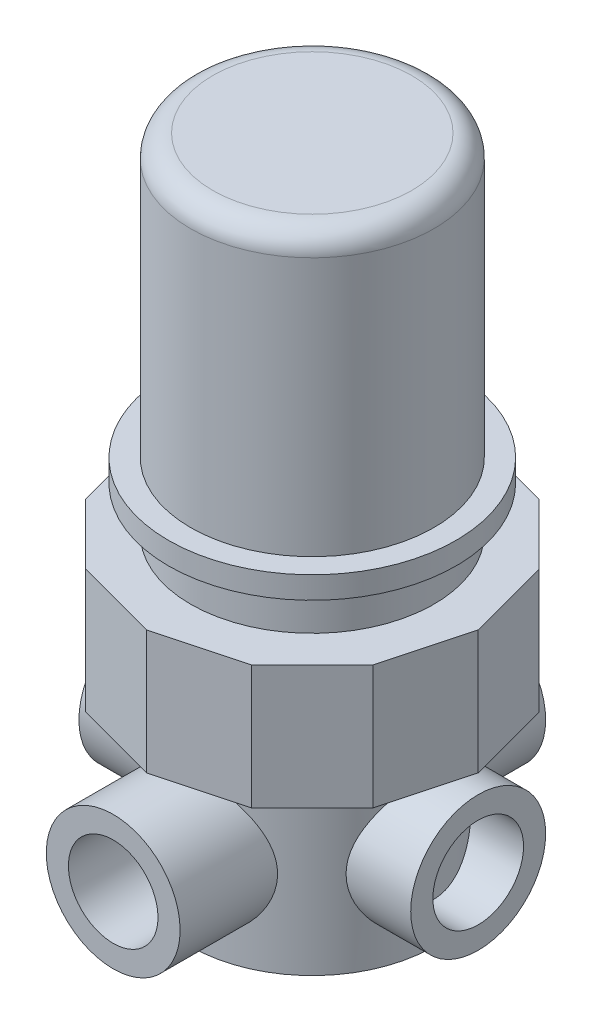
SolidWorks part; units mm, degrees
ref_plane "Front Plane" through (0, 0, 0) normal (0, 0, 1) x (1, 0, 0)
ref_plane "Top Plane" through (0, 0, 0) normal (0, 1, 0) x (1, 0, 0)
ref_plane "Right Plane" through (0, 0, 0) normal (1, 0, 0) x (0, 0, -1)
sketch "Sketch1" plane through (0, 0, 0) normal (0, 0, 1) x (1, 0, 0)
  line L0 (0, 73.914) -> (0, 0) construction
  line L1 (0, 73.914) -> (13.97, 73.914)
  line L2 (13.97, 73.914) -> (13.97, 41.656)
  line L3 (13.97, 41.656) -> (16.51, 41.656)
  line L4 (16.51, 41.656) -> (16.51, 39.116)
  line L5 (16.51, 39.116) -> (13.97, 39.116)
  line L6 (13.97, 39.116) -> (13.97, 34.036)
  line L7 (13.97, 34.036) -> (19.05, 34.036)
  line L8 (19.05, 34.036) -> (19.05, 19.812)
  line L9 (19.05, 19.812) -> (13.97, 19.812)
  line L10 (13.97, 19.812) -> (13.97, 0)
  line L11 (13.97, 0) -> (0, 0)
  line L12 (0, 73.914) -> (0, 0)
  point P11 (13.97, 9.906)
  dimension "D1" = 73.914
  dimension "D2" = 24.13
  dimension "D3" = 64.008
  dimension "D4" = 38.1
  dimension "D5" = 27.94
  dimension "D6" = 27.94
  dimension "D7" = 2.54
  dimension "D8" = 2.54
  dimension "D9" = 5.08
revolve "Revolve1" add sketch "Sketch1" angle 360 about L0
sketch "Sketch2" plane through (0, 34.036, 0) normal (0, 1, 0) x (1, 0, 0)
  line L1 (0, 19.05) -> (-9.525, 16.4978)
  line L2 (-9.525, 16.4978) -> (-16.4978, 9.525)
  line L3 (-16.4978, 9.525) -> (-19.05, 0)
  line L4 (-19.05, 0) -> (-16.4978, -9.525)
  line L5 (-16.4978, -9.525) -> (-9.525, -16.4978)
  line L6 (-9.525, -16.4978) -> (0, -19.05)
  line L7 (0, -19.05) -> (9.525, -16.4978)
  line L8 (9.525, -16.4978) -> (16.4978, -9.525)
  line L9 (16.4978, -9.525) -> (19.05, 0)
  line L10 (19.05, 0) -> (16.4978, 9.525)
  line L11 (16.4978, 9.525) -> (9.525, 16.4978)
  line L12 (9.525, 16.4978) -> (0, 19.05)
  circle A0 centre (0, 0) radius 18.4009 construction
  circle A1 centre (0, 0) radius 19.05 construction
  circle A2 centre (0, 0) radius 19.05
extrude "Cut-Extrude1" cut sketch "Sketch2" against normal up to next contours L2 M2 | L3 M2 | L4 M2 | L5 M2 | L6 M2 | L7 M2 | L8 M2 | L9 M2 | L10 M2 | L11 M2 | L12 M2 | L1 M2 | A2
ref_plane "Plane1" through (0, 0, 13.97) normal (0, 0, 1) x (1, 0, 0)
sketch "Sketch3" plane through (0, 0, 13.97) normal (0, 0, 1) x (1, 0, 0)
  line L0 (0, 0) -> (0, 19.812) construction
  line L1 (-13.97, 19.812) -> (13.97, 19.812) construction
  circle A0 centre (0, 9.906) radius 5.1435
  circle A1 centre (0, 9.906) radius 7.6835
  point P8 (0, 9.906)
  dimension "D1" = 10.287
  dimension "D2" = 2.54
extrude "Boss-Extrude1" add sketch "Sketch3" along normal blind 8.89 and the other way up to surface (8.89 mm away)
ref_plane "Plane2" through (13.97, 0, 0) normal (1, 0, 0) x (0, 0, -1)
sketch "Sketch4" plane through (13.97, 0, 0) normal (1, 0, 0) x (0, 0, -1)
  line L0 (0, 19.812) -> (0, 0) construction
  line L1 (-13.97, 19.812) -> (13.97, 19.812) construction
  circle A0 centre (0, 9.906) radius 5.207
  circle A1 centre (0, 9.906) radius 7.747
  point P8 (0, 9.906)
  dimension "D1" = 10.414
  dimension "D2" = 2.54
extrude "Boss-Extrude2" add sketch "Sketch4" along normal blind 5.08 and the other way up to surface (5.08 mm away)
pattern_circular "CirPattern1" count 4 over 360 about axis through (0, 73.914, 0) along (0, 1, 0) of "Boss-Extrude2"
fillet "Fillet1" radius 2.54 1 edges at (0, 73.914, 13.97)
